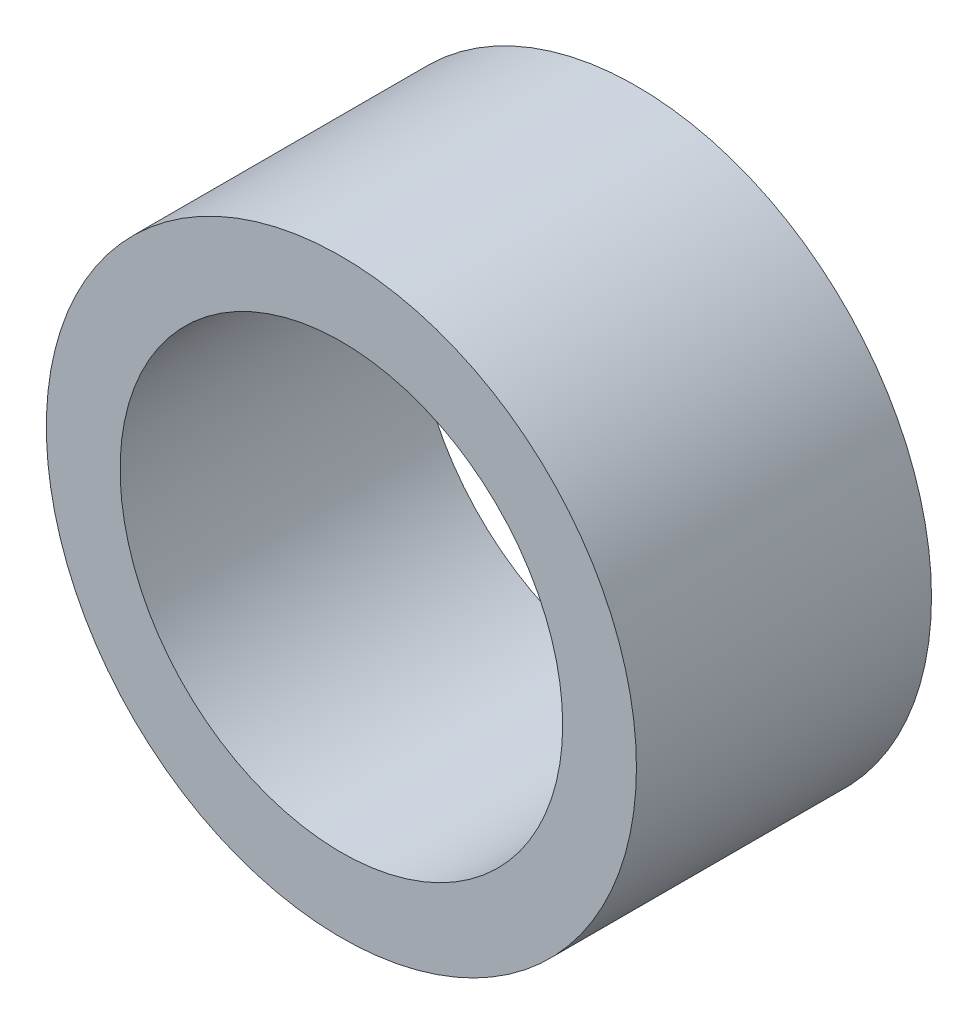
SolidWorks part; units mm, degrees
ref_plane "Front X-Y" through (0, 0, 0) normal (0, 0, 1) x (1, 0, 0)
ref_plane "Top X-Z" through (0, 0, 0) normal (0, 1, 0) x (1, 0, 0)
ref_plane "Right Y-Z" through (0, 0, 0) normal (1, 0, 0) x (0, 0, -1)
ref_plane "Plane1" through (0, 0, 0) normal (0, 0, 1) x (1, 0, 0)
sketch "Sketch1" plane through (0, 0, 0) normal (0, 0, 1) x (1, 0, 0)
  circle A0 centre (0, 0) radius 10
  circle A1 centre (0, 0) radius 7.5
extrude "Boss-Extrude1" add sketch "Sketch1" along normal blind 10
